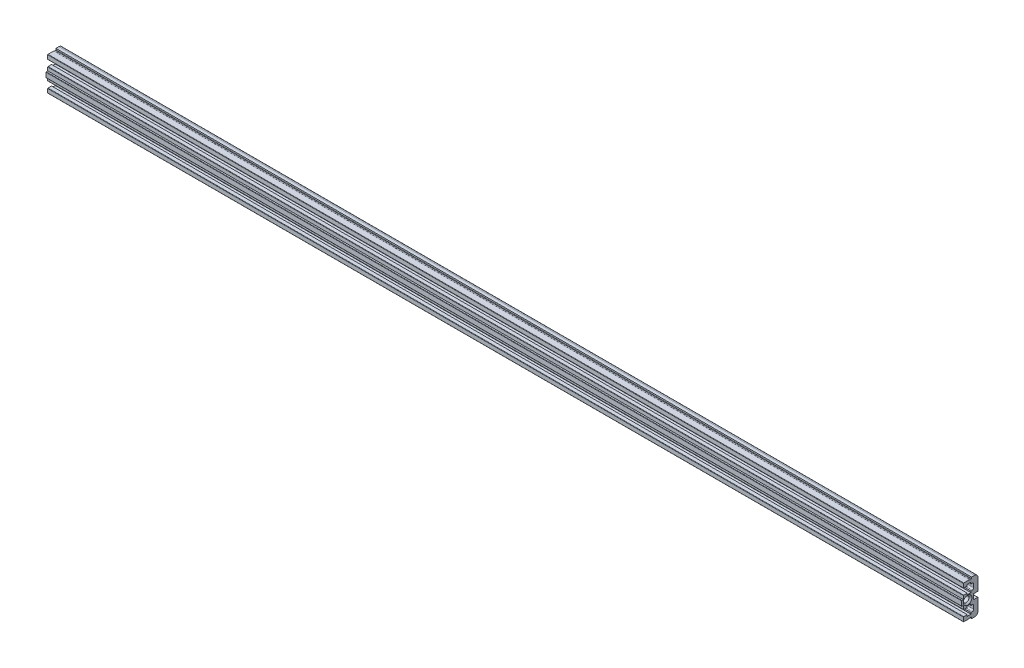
SolidWorks part; units mm, degrees
other "1"
ref_plane "前视基准面" through (0, 0, 0) normal (0, 0, 1) x (1, 0, 0)
ref_plane "上视基准面" through (0, 0, 0) normal (0, 1, 0) x (1, 0, 0)
ref_plane "右视基准面" through (0, 0, 0) normal (1, 0, 0) x (0, 0, -1)
imported_body "输入1"
sketch "草图1" plane through (215.9, 0, 0) normal (1, 0, 0) x (0, 0, -1)
  line L1 (-19.3491, 1.2285) -> (-7.2897, 1.2285)
  line L2 (-19.3491, 1.2285) -> (-19.3491, -21.0563)
  line L3 (-19.3491, -21.0563) -> (-7.2897, -21.0563)
  line L4 (-7.2897, 1.2285) -> (-7.2897, -21.0563)
extrude "切除-拉伸1" cut sketch "草图1" against normal blind 20
sketch "草图2" plane through (195.9, 0, 0) normal (1, 0, 0) x (0, 0, -1)
  line L42 (-18.05, -11.4) -> (-17.25, -11.4)
  line L43 (-17.25, -11.4) -> (-17.25, -13.35)
  line L44 (-17.05, -13.55) -> (-15.05, -13.55)
  line L45 (-15.05, -13.55) -> (-15.05, -12.7)
  line L46 (-15.05, -12.7) -> (-12.85, -12.7)
  line L47 (-12.85, -12.7) -> (-12.85, -13.55)
  line L48 (-12.85, -13.55) -> (-12.05, -13.55)
  line L49 (-11.25, -14.35) -> (-11.25, -16.3)
  line L50 (-12.05, -17.1) -> (-12.85, -17.1)
  line L51 (-12.85, -17.1) -> (-12.85, -17.95)
  line L52 (-12.85, -17.95) -> (-15.05, -17.95)
  line L53 (-15.05, -17.95) -> (-15.05, -17.1)
  line L54 (-15.05, -17.1) -> (-17.05, -17.1)
  line L55 (-17.25, -17.3) -> (-17.25, -19.5)
  line L56 (-17.05, -19.7) -> (-13.6873, -19.7)
  line L57 (-13.3, -19.4) -> (-12.7, -19.4)
  line L58 (-12.5, -19.6) -> (-12.5, -20.4)
  line L59 (-12.5, -20.4) -> (-10.75, -20.4)
  line L60 (-8.75, -18.4) -> (-8.75, -11.6)
  line L61 (-8.95, -11.4) -> (-11.25, -11.4)
  line L62 (-11.25, -11.4) -> (-11.25, -8.4)
  line L63 (-11.25, -8.4) -> (-8.95, -8.4)
  line L64 (-8.75, -8.2) -> (-8.75, -1.4)
  line L65 (-10.75, 0.6) -> (-12.5, 0.6)
  line L66 (-12.5, 0.6) -> (-12.5, -0.2)
  line L67 (-12.7, -0.4) -> (-13.3, -0.4)
  line L68 (-13.6873, -0.1) -> (-17.05, -0.1)
  line L69 (-17.25, -0.3) -> (-17.25, -2.5)
  line L70 (-17.05, -2.7) -> (-15.05, -2.7)
  line L71 (-15.05, -2.7) -> (-15.05, -1.85)
  line L72 (-15.05, -1.85) -> (-12.85, -1.85)
  line L73 (-12.85, -1.85) -> (-12.85, -2.7)
  line L74 (-12.85, -2.7) -> (-12.05, -2.7)
  line L75 (-11.25, -3.5) -> (-11.25, -5.45)
  line L76 (-12.05, -6.25) -> (-12.85, -6.25)
  line L77 (-12.85, -6.25) -> (-12.85, -7.1)
  line L78 (-12.85, -7.1) -> (-15.05, -7.1)
  line L79 (-15.05, -7.1) -> (-15.05, -6.25)
  line L80 (-15.05, -6.25) -> (-17.05, -6.25)
  line L81 (-17.25, -6.45) -> (-17.25, -8.4)
  line L82 (-17.25, -8.4) -> (-18.05, -8.4)
  line L83 (-18.25, -8.6) -> (-18.25, -11.2)
  line L84 (-18.05, -11.4) -> (-17.25, -11.4)
  line L85 (-17.25, -11.4) -> (-17.25, -13.35)
  line L86 (-17.05, -13.55) -> (-15.05, -13.55)
  line L87 (-15.05, -13.55) -> (-15.05, -12.7)
  line L88 (-15.05, -12.7) -> (-12.85, -12.7)
  line L89 (-12.85, -12.7) -> (-12.85, -13.55)
  line L90 (-12.85, -13.55) -> (-12.05, -13.55)
  line L91 (-11.25, -14.35) -> (-11.25, -16.3)
  line L92 (-12.05, -17.1) -> (-12.85, -17.1)
  line L93 (-12.85, -17.1) -> (-12.85, -17.95)
  line L94 (-12.85, -17.95) -> (-15.05, -17.95)
  line L95 (-15.05, -17.95) -> (-15.05, -17.1)
  line L96 (-15.05, -17.1) -> (-17.05, -17.1)
  line L97 (-17.25, -17.3) -> (-17.25, -19.5)
  line L98 (-17.05, -19.7) -> (-13.6873, -19.7)
  line L99 (-13.3, -19.4) -> (-12.7, -19.4)
  line L100 (-12.5, -19.6) -> (-12.5, -20.4)
  line L101 (-12.5, -20.4) -> (-10.75, -20.4)
  line L102 (-8.75, -18.4) -> (-8.75, -11.6)
  line L103 (-8.95, -11.4) -> (-11.25, -11.4)
  line L104 (-11.25, -11.4) -> (-11.25, -8.4)
  line L105 (-11.25, -8.4) -> (-8.95, -8.4)
  line L106 (-8.75, -8.2) -> (-8.75, -1.4)
  line L107 (-10.75, 0.6) -> (-12.5, 0.6)
  line L108 (-12.5, 0.6) -> (-12.5, -0.2)
  line L109 (-12.7, -0.4) -> (-13.3, -0.4)
  line L110 (-13.6873, -0.1) -> (-17.05, -0.1)
  line L111 (-17.25, -0.3) -> (-17.25, -2.5)
  line L112 (-17.05, -2.7) -> (-15.05, -2.7)
  line L113 (-15.05, -2.7) -> (-15.05, -1.85)
  line L114 (-15.05, -1.85) -> (-12.85, -1.85)
  line L115 (-12.85, -1.85) -> (-12.85, -2.7)
  line L116 (-12.85, -2.7) -> (-12.05, -2.7)
  line L117 (-11.25, -3.5) -> (-11.25, -5.45)
  line L118 (-12.05, -6.25) -> (-12.85, -6.25)
  line L119 (-12.85, -6.25) -> (-12.85, -7.1)
  line L120 (-12.85, -7.1) -> (-15.05, -7.1)
  line L121 (-15.05, -7.1) -> (-15.05, -6.25)
  line L122 (-15.05, -6.25) -> (-17.05, -6.25)
  line L123 (-17.25, -6.45) -> (-17.25, -8.4)
  line L124 (-17.25, -8.4) -> (-18.05, -8.4)
  line L125 (-18.25, -8.6) -> (-18.25, -11.2)
  circle A0 centre (-14.8, -9.9) radius 1.25 construction
  circle A1 centre (-14.8, -9.9) radius 1.25
  arc A22 (-18.25, -11.2) -> (-18.05, -11.4) centre (-18.05, -11.2) ccw
  arc A23 (-17.25, -13.35) -> (-17.05, -13.55) centre (-17.05, -13.35) ccw
  arc A24 (-11.25, -14.35) -> (-12.05, -13.55) centre (-12.05, -14.35) ccw
  arc A25 (-12.05, -17.1) -> (-11.25, -16.3) centre (-12.05, -16.3) ccw
  arc A26 (-17.05, -17.1) -> (-17.25, -17.3) centre (-17.05, -17.3) ccw
  arc A27 (-17.25, -19.5) -> (-17.05, -19.7) centre (-17.05, -19.5) ccw
  arc A28 (-13.6873, -19.7) -> (-13.4936, -19.55) centre (-13.6873, -19.5) ccw
  arc A29 (-13.3, -19.4) -> (-13.4936, -19.55) centre (-13.3, -19.6) ccw
  arc A30 (-12.5, -19.6) -> (-12.7, -19.4) centre (-12.7, -19.6) ccw
  arc A31 (-10.75, -20.4) -> (-8.75, -18.4) centre (-10.75, -18.4) ccw
  arc A32 (-8.75, -11.6) -> (-8.95, -11.4) centre (-8.95, -11.6) ccw
  arc A33 (-8.95, -8.4) -> (-8.75, -8.2) centre (-8.95, -8.2) ccw
  arc A34 (-8.75, -1.4) -> (-10.75, 0.6) centre (-10.75, -1.4) ccw
  arc A35 (-12.7, -0.4) -> (-12.5, -0.2) centre (-12.7, -0.2) ccw
  arc A36 (-13.4936, -0.25) -> (-13.3, -0.4) centre (-13.3, -0.2) ccw
  arc A37 (-13.4936, -0.25) -> (-13.6873, -0.1) centre (-13.6873, -0.3) ccw
  arc A38 (-17.05, -0.1) -> (-17.25, -0.3) centre (-17.05, -0.3) ccw
  arc A39 (-17.25, -2.5) -> (-17.05, -2.7) centre (-17.05, -2.5) ccw
  arc A40 (-11.25, -3.5) -> (-12.05, -2.7) centre (-12.05, -3.5) ccw
  arc A41 (-12.05, -6.25) -> (-11.25, -5.45) centre (-12.05, -5.45) ccw
  arc A42 (-17.05, -6.25) -> (-17.25, -6.45) centre (-17.05, -6.45) ccw
  arc A43 (-18.05, -8.4) -> (-18.25, -8.6) centre (-18.05, -8.6) ccw
  arc A44 (-18.25, -11.2) -> (-18.05, -11.4) centre (-18.05, -11.2) ccw
  arc A45 (-17.25, -13.35) -> (-17.05, -13.55) centre (-17.05, -13.35) ccw
  arc A46 (-11.25, -14.35) -> (-12.05, -13.55) centre (-12.05, -14.35) ccw
  arc A47 (-12.05, -17.1) -> (-11.25, -16.3) centre (-12.05, -16.3) ccw
  arc A48 (-17.05, -17.1) -> (-17.25, -17.3) centre (-17.05, -17.3) ccw
  arc A49 (-17.25, -19.5) -> (-17.05, -19.7) centre (-17.05, -19.5) ccw
  arc A50 (-13.6873, -19.7) -> (-13.4936, -19.55) centre (-13.6873, -19.5) ccw
  arc A51 (-13.3, -19.4) -> (-13.4936, -19.55) centre (-13.3, -19.6) ccw
  arc A52 (-12.5, -19.6) -> (-12.7, -19.4) centre (-12.7, -19.6) ccw
  arc A53 (-10.75, -20.4) -> (-8.75, -18.4) centre (-10.75, -18.4) ccw
  arc A54 (-8.75, -11.6) -> (-8.95, -11.4) centre (-8.95, -11.6) ccw
  arc A55 (-8.95, -8.4) -> (-8.75, -8.2) centre (-8.95, -8.2) ccw
  arc A56 (-8.75, -1.4) -> (-10.75, 0.6) centre (-10.75, -1.4) ccw
  arc A57 (-12.7, -0.4) -> (-12.5, -0.2) centre (-12.7, -0.2) ccw
  arc A58 (-13.4936, -0.25) -> (-13.3, -0.4) centre (-13.3, -0.2) ccw
  arc A59 (-13.4936, -0.25) -> (-13.6873, -0.1) centre (-13.6873, -0.3) ccw
  arc A60 (-17.05, -0.1) -> (-17.25, -0.3) centre (-17.05, -0.3) ccw
  arc A61 (-17.25, -2.5) -> (-17.05, -2.7) centre (-17.05, -2.5) ccw
  arc A62 (-11.25, -3.5) -> (-12.05, -2.7) centre (-12.05, -3.5) ccw
  arc A63 (-12.05, -6.25) -> (-11.25, -5.45) centre (-12.05, -5.45) ccw
  arc A64 (-17.05, -6.25) -> (-17.25, -6.45) centre (-17.05, -6.45) ccw
  arc A65 (-18.05, -8.4) -> (-18.25, -8.6) centre (-18.05, -8.6) ccw
  dimension "D1" = 0
extrude "凸台-拉伸1" add sketch "草图2" along normal blind 121.6
sketch "草图3" plane through (317.5, 0, 0) normal (1, 0, 0) x (0, 0, -1)
  circle A0 centre (-14.8, -9.9) radius 1.65
extrude "切除-拉伸2" cut sketch "草图3" against normal blind 15.02
chamfer "倒角1" distance 0.85 angle 45 1 edges at (317.5, -9.9, 13.15)
